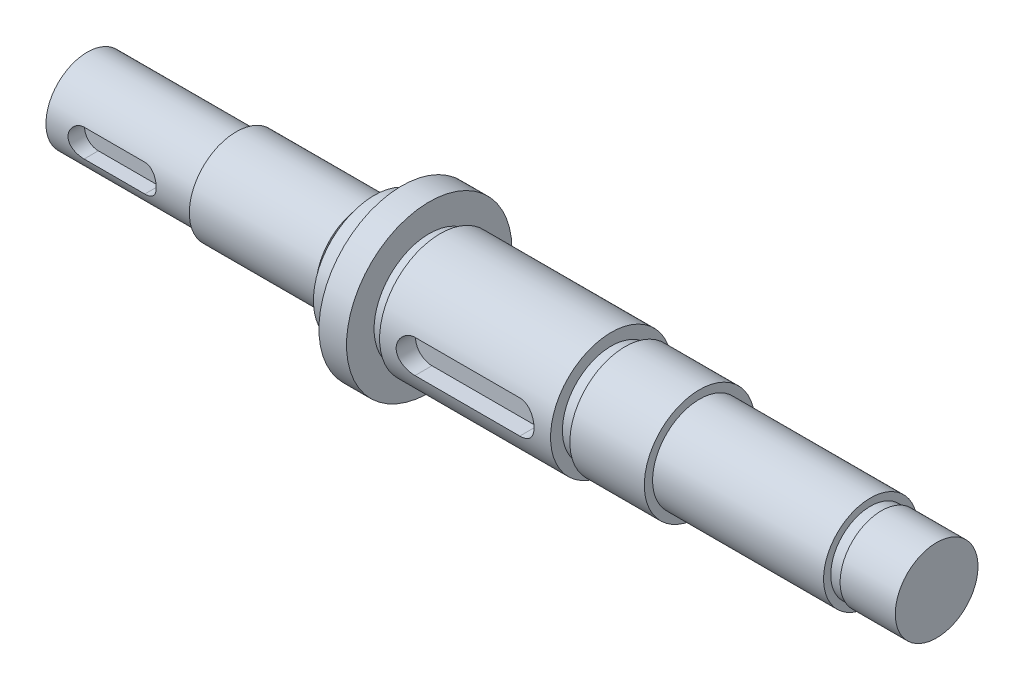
SolidWorks part; units mm, degrees
ref_plane "前视基准面" through (0, 0, 0) normal (0, 0, 1) x (1, 0, 0)
ref_plane "上视基准面" through (0, 0, 0) normal (0, 1, 0) x (1, 0, 0)
ref_plane "右视基准面" through (0, 0, 0) normal (1, 0, 0) x (0, 0, -1)
sketch "草图4" plane through (0, 0, 0) normal (1, 0, 0) x (0, 0, -1)
  circle A0 centre (0, 0) radius 7.5
extrude "拉伸1" add sketch "草图4" along normal blind 27
sketch "草图7" plane through (27, 0, 0) normal (1, 0, 0) x (0, 0, -1)
  circle A0 centre (0, 0) radius 8.5
extrude "拉伸2" add sketch "草图7" along normal blind 23
sketch "草图8" plane through (50, 0, 0) normal (1, 0, 0) x (0, 0, -1)
  circle A0 centre (0, 0) radius 8.2
extrude "拉伸3" add sketch "草图8" along normal blind 2
sketch "草图9" plane through (52, 0, 0) normal (1, 0, 0) x (0, 0, -1)
  circle A0 centre (0, 0) radius 11
extrude "拉伸4" add sketch "草图9" along normal blind 5
sketch "草图10" plane through (57, 0, 0) normal (1, 0, 0) x (0, 0, -1)
  circle A0 centre (0, 0) radius 15
extrude "拉伸5" add sketch "草图10" along normal blind 5
sketch "草图11" plane through (62, 0, 0) normal (1, 0, 0) x (0, 0, -1)
  circle A0 centre (0, 0) radius 10
extrude "拉伸6" add sketch "草图11" along normal blind 2
sketch "草图12" plane through (64, 0, 0) normal (1, 0, 0) x (0, 0, -1)
  circle A0 centre (0, 0) radius 11
extrude "拉伸7" add sketch "草图12" along normal blind 31
sketch "草图13" plane through (95, 0, 0) normal (1, 0, 0) x (0, 0, -1)
  circle A0 centre (0, 0) radius 8.85
extrude "拉伸8" add sketch "草图13" along normal blind 2.5
sketch "草图14" plane through (97.5, 0, 0) normal (1, 0, 0) x (0, 0, -1)
  circle A0 centre (0, 0) radius 10
extrude "拉伸9" add sketch "草图14" along normal blind 13.5
sketch "草图15" plane through (111, 0, 0) normal (1, 0, 0) x (0, 0, -1)
  circle A0 centre (0, 0) radius 8.5
extrude "拉伸10" add sketch "草图15" along normal blind 31
sketch "草图16" plane through (142, 0, 0) normal (1, 0, 0) x (0, 0, -1)
  circle A0 centre (0, 0) radius 7.2
extrude "拉伸11" add sketch "草图16" along normal blind 2
sketch "草图17" plane through (144, 0, 0) normal (1, 0, 0) x (0, 0, -1)
  circle A0 centre (0, 0) radius 7.5
extrude "拉伸12" add sketch "草图17" along normal blind 10
ref_plane "基准面1" through (0, 0, 7.5) normal (0, 0, 1) x (1, 0, 0)
sketch "草图18" plane through (0, 0, 7.5) normal (0, 0, 1) x (1, 0, 0)
  line L0 (6.5, 2.5) -> (17.5, 2.5)
  line L1 (6.5, -2.5) -> (17.5, -2.5)
  arc A0 (6.5, 2.5) -> (6.5, -2.5) centre (6.5, 0) ccw
  arc A1 (17.5, -2.5) -> (17.5, 2.5) centre (17.5, 0) ccw
  point P0 (6.5, 0)
  point P1 (17.5, 0)
extrude "切除-拉伸1" cut sketch "草图18" against normal blind 3
ref_plane "基准面2" through (0, 0, 11) normal (0, 0, 1) x (1, 0, 0)
sketch "草图20" plane through (0, 0, 11) normal (0, 0, 1) x (1, 0, 0)
  line L0 (70, 3) -> (89, 3)
  line L1 (70, -3) -> (89, -3)
  arc A0 (70, 3) -> (70, -3) centre (70, 0) ccw
  arc A1 (89, -3) -> (89, 3) centre (89, 0) ccw
  point P0 (70, 0)
  point P1 (89, 0)
extrude "切除-拉伸2" cut sketch "草图20" against normal blind 3.5
